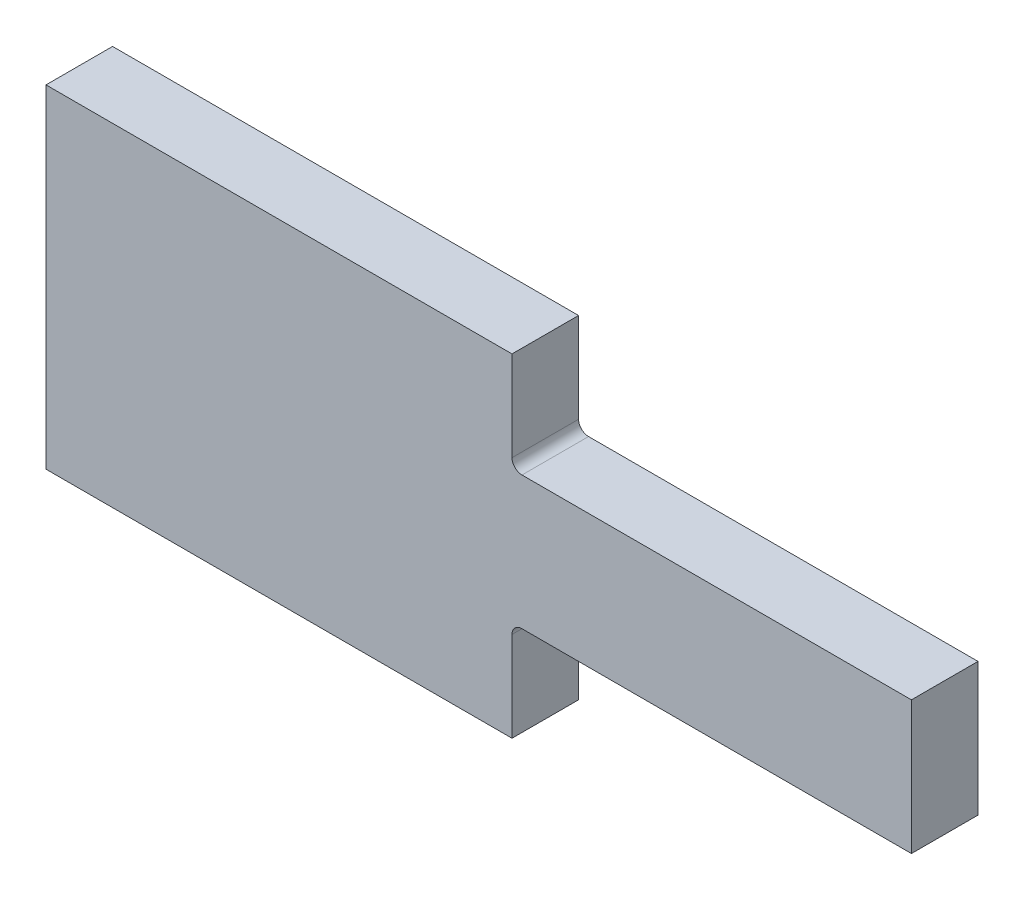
SolidWorks part; units mm, degrees
ref_plane "Ebene vorne" through (0, 0, 0) normal (0, 0, 1) x (1, 0, 0)
ref_plane "Ebene oben" through (0, 0, 0) normal (0, 1, 0) x (1, 0, 0)
ref_plane "Ebene rechts" through (0, 0, 0) normal (1, 0, 0) x (0, 0, -1)
sketch "Skizze1" plane through (0, 0, 0) normal (0, 0, 1) x (1, 0, 0)
  line L0 (0, -50) -> (0, 50)
  line L1 (0, 50) -> (140, 50)
  line L2 (140, 50) -> (140, 20)
  line L3 (140, 20) -> (260, 20)
  line L4 (260, 20) -> (260, -20)
  line L5 (260, -20) -> (140, -20)
  line L6 (140, -20) -> (140, -50)
  line L7 (140, -50) -> (0, -50)
  line L8 (-10.5417, 0) -> (297.9299, 0) construction
  dimension "D1" = 100
  dimension "D2" = 140
  dimension "D3" = 40
  dimension "D4" = 260
extrude "Aufsatz-Linear austragen1" add sketch "Skizze1" along normal blind 20
fillet "Verrundung1" radius 3 2 edges at (140, -20, 10) (140, 20, 10)
